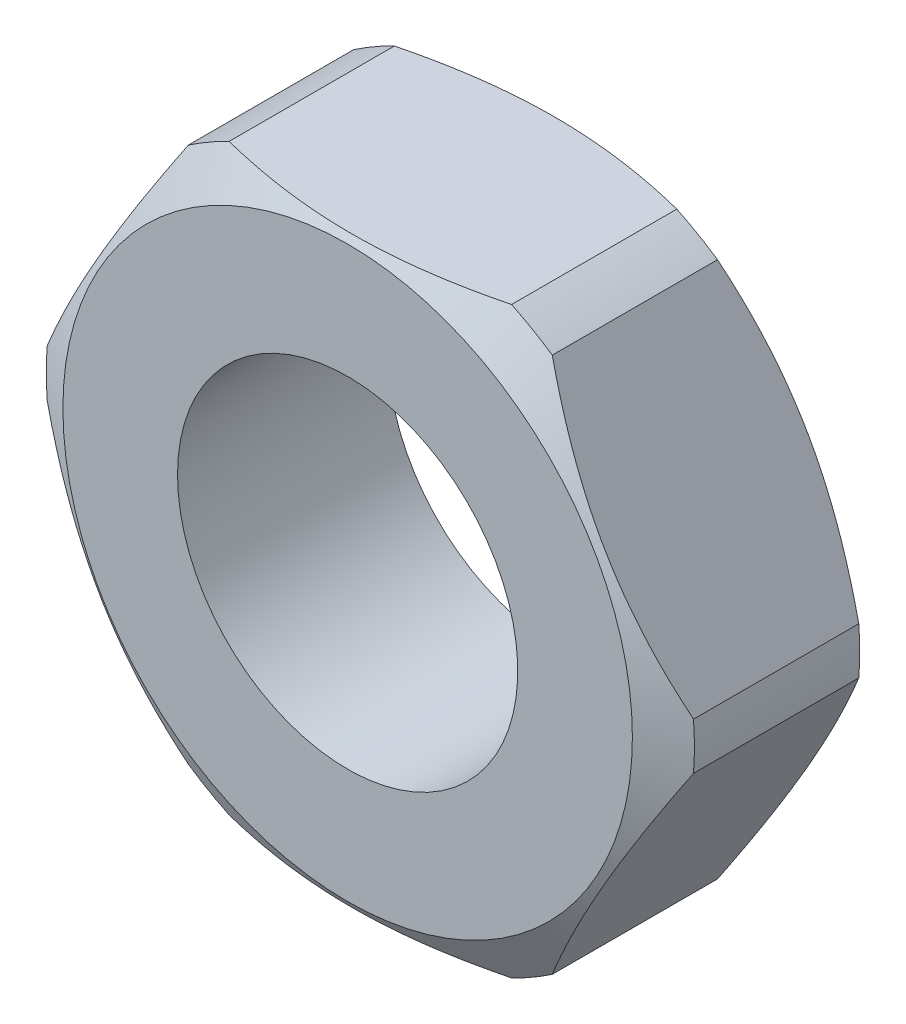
SolidWorks part; units mm, degrees
ref_plane "Plan1" through (0, 0, 0) normal (0, 0, 1) x (1, 0, 0)
ref_plane "Plan2" through (0, 0, 0) normal (0, 1, 0) x (1, 0, 0)
ref_plane "Plan3" through (0, 0, 0) normal (1, 0, 0) x (0, 0, -1)
sketch "Esquisse4" plane through (0, 0, 0) normal (0, 0, 1) x (1, 0, 0)
  circle A0 centre (0, 0) radius 10
  circle A1 centre (0, 0) radius 5.25
  dimension "D1" = 10.5
  dimension "D2" = 20
extrude "Base-Extrusion" add sketch "Esquisse4" along normal blind 6.5
chamfer "Chanfrein1" distance 0.7 angle 60
sketch "Esquisse6" plane through (0, 0, 6.5) normal (0, 0, 1) x (1, 0, 0)
  line L0 (-4.5837, 9) -> (4.5837, 9)
  line L1 (5.5021, 8.4697) -> (10.0858, 0.5306)
  line L2 (10.0858, -0.53) -> (5.5021, -8.4691)
  line L3 (4.5837, -8.9994) -> (-4.5837, -8.9994)
  line L4 (-5.5021, -8.4691) -> (-10.0858, -0.53)
  line L5 (-10.0858, 0.5306) -> (-5.5021, 8.4697)
  circle A0 centre (0, 0) radius 5.25 construction
  arc A1 (4.5837, 9) -> (-4.5837, 9) centre (0, 0) ccw
  arc A3 (10.0858, 0.5306) -> (5.5021, 8.4697) centre (-0.0003, 0.0002) ccw
  arc A4 (5.5021, -8.4691) -> (10.0858, -0.53) centre (-0.0003, 0.0005) ccw
  arc A5 (-4.5837, -8.9994) -> (4.5837, -8.9994) centre (0, 0.0006) ccw
  arc A6 (-10.0858, -0.53) -> (-5.5021, -8.4691) centre (0.0003, 0.0005) ccw
  arc A7 (-5.5021, 8.4697) -> (-10.0858, 0.5306) centre (0.0003, 0.0002) ccw
  dimension "D1" = 9
  dimension "D2" = 10.1
extrude "Enlèv. mat.-Extru.3" cut sketch "Esquisse6" against normal blind 6.5
